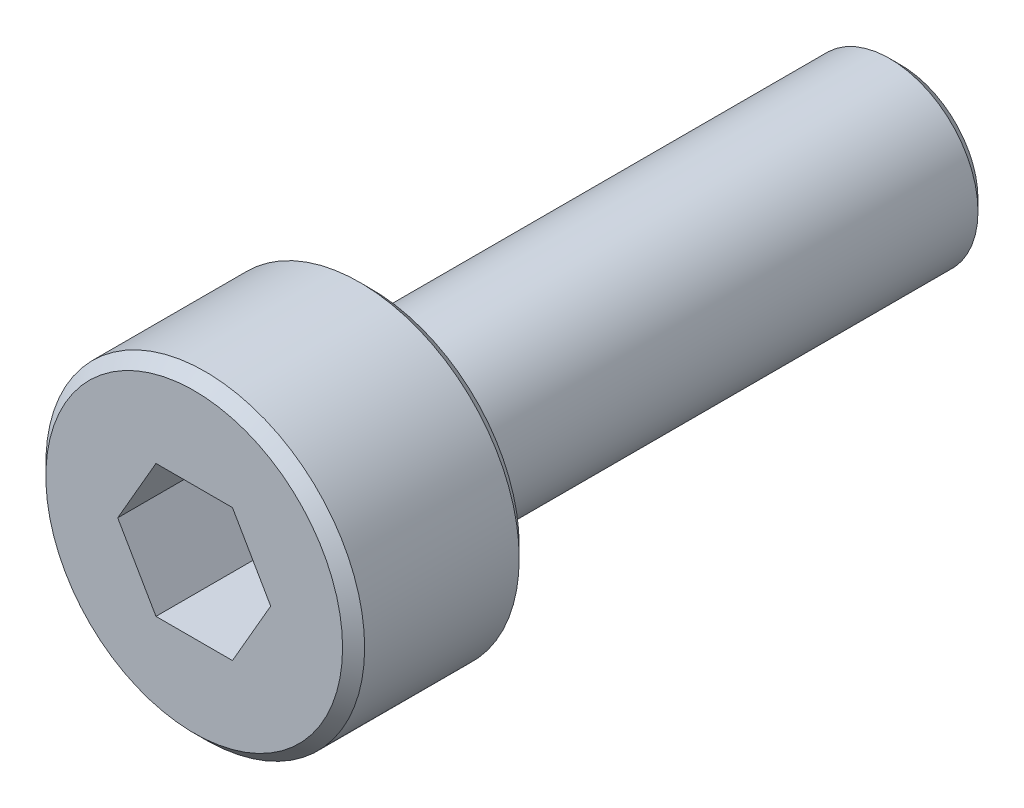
SolidWorks part; units mm, degrees
ref_plane "Front Plane" through (0, 0, 0) normal (1, 0, 0) x (0, 1, 0)
ref_plane "Top Plane" through (0, 0, 0) normal (0, 0, 1) x (0, 1, 0)
ref_plane "Right Plane" through (0, 0, 0) normal (0, 1, 0) x (-1, 0, 0)
sketch "Sketch1" plane through (0, 0, 0) normal (0, 0, 1) x (0, 1, 0)
  circle A0 centre (0, 0) radius 2
  dimension "D1" = 4
extrude "Boss-Extrude1" add sketch "Sketch1" along normal blind 12
sketch "Sketch2" plane through (0, 0, 12) normal (0, 0, 1) x (1, 0, 0)
  circle A0 centre (0, 0) radius 3.61
  dimension "D1" = 7.22
extrude "Boss-Extrude2" add sketch "Sketch2" along normal blind 4
sketch "Sketch3" plane through (0, 0, 16) normal (0, 0, 1) x (1, 0, 0)
  line L1 (1.7321, 0) -> (0.866, 1.5)
  line L2 (0.866, 1.5) -> (-0.866, 1.5)
  line L3 (-0.866, 1.5) -> (-1.7321, 0)
  line L4 (-1.7321, 0) -> (-0.866, -1.5)
  line L5 (-0.866, -1.5) -> (0.866, -1.5)
  line L6 (0.866, -1.5) -> (1.7321, 0)
  circle A0 centre (0, 0) radius 1.5 construction
  dimension "D1" = 3
extrude "Cut-Extrude1" cut sketch "Sketch3" against normal blind 2.5
chamfer "Chamfer1" distance 0.25 angle 45 3 edges at (2, 0, 0) (3.61, 0, 12) (3.61, 0, 16)
